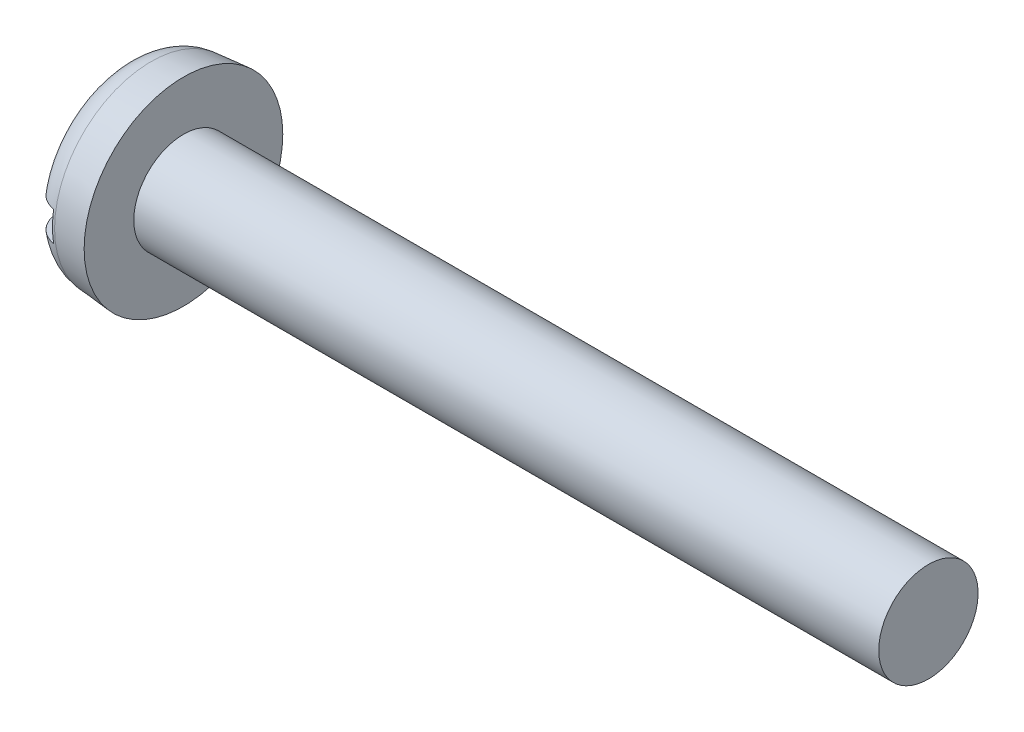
SolidWorks part; units mm, degrees
ref_plane "Plane1" through (0, 0, 0) normal (0, 0, 1) x (1, 0, 0)
ref_plane "Plane2" through (0, 0, 0) normal (0, 1, 0) x (1, 0, 0)
ref_plane "Plane3" through (0, 0, 0) normal (1, 0, 0) x (0, 0, -1)
sketch "BodySke" plane through (0, 0, 0) normal (0, 0, 1) x (1, 0, 0)
  line L0 (2.4, 2) -> (2.4, 4)
  line L1 (0, 0) -> (0, 3.79)
  line L2 (-25.4, 0) -> (127, 0) construction
  line L3 (32.4, 0) -> (0, 0)
  line L4 (2.4, 2) -> (32.4, 2)
  line L5 (32.4, 2) -> (32.4, 0)
  line L6 (0, 3.79) -> (2.4, 4)
  line L9 (3.1, 3.5875) -> (3.1, -5.9375) construction
  line L10 (2.4, 6.35) -> (2.4, -3.175) construction
  dimension "Head_ht" = 2.4
  dimension "Diameter" = 4
  dimension "Length" = 30
  dimension "Head_dia" = 8
  dimension "Advance" = 0.7
  dimension "Thread_nom" = 30
  dimension "Head_side_angle" = 5
revolve "Base-Revolve" add sketch "BodySke"
fillet "Fillet1" [suppressed] radius 0.2
fillet "Fillet2" radius 1.2 1 edges at (0, 0, 3.79)
sketch "Sketch2" plane through (0, 0, 0) normal (1, 0, 0) x (0, 0, -1)
  line L0 (4, -0.6) -> (-4, -0.6)
  line L1 (4, -0.6) -> (4, 0.6)
  line L2 (-4, 0.6) -> (4, 0.6)
  line L3 (-4, 0.6) -> (-4, -0.6)
  dimension "D1" = 8
  dimension "D2" = 4
  dimension "Slot_width" = 1.2
  dimension "D3" = 0.6
extrude "Slot" cut sketch "Sketch2" along normal blind 1
sketch "ThdSchSke" plane through (0, 0, 0) normal (0, 0, 1) x (1, 0, 0)
  line L0 (3.8, -1.61) -> (3.5269, -2)
  line L1 (3.8, -1.61) -> (4.0731, -2)
  line L2 (4.0731, -2) -> (4.0731, -2.5)
  line L3 (-3.175, 0) -> (5.1513, 0) construction
  line L5 (4.0731, -2.5) -> (3.5269, -2.5)
  line L6 (3.5269, -2.5) -> (3.5269, -2)
  dimension "Thread_minor" = 3.22
  dimension "Diameter" = 4
  dimension "Start" = 3.8
  dimension "SideAngle" = 55
  dimension "VeeAngle" = 70
  dimension "Overcut" = 5
revolve "ThreadSchematic" [suppressed] cut sketch "ThdSchSke" angle 360 about L3
pattern_linear "ThdSchPat" [suppressed]
equation "\"D1@Sketch2\" = \"Head_dia@BodySke\""
equation "\"D2@Sketch2\" = \"D1@Sketch2\" / 2"
equation "\"D3@Sketch2\" = \"Slot_width@Sketch2\" / 2"
equation "\"Thread_length@ThreadCosmetic\" = ((sgn( (\"Length@BodySke\" - \"Advance@BodySke\" * 2.0 ) - \"Thread_nom@BodySke\" )-1)*( (\"Length@BodySke\" - \"Advance@BodySke\"  * 2.0) - \"Thread_nom@BodySke\" ))/-2+ \"Thread_"
equation "\"Thread_minor@ThdSchSke\" = \"Thread_minor@ThreadCosmetic\""
equation "\"Diameter@ThdSchSke\" = \"Diameter@BodySke\""
equation "\"Overcut@ThdSchSke\" = \"Diameter@BodySke\" * 1.25"
equation "\"Start@ThdSchSke\" = \"Head_ht@BodySke\" + \"Length@BodySke\" - \"Thread_length@ThreadCosmetic\"  '---Non-countersunk---"
equation "\"Num_threads@ThdSchPat\" = int( \"Thread_length@ThreadCosmetic\" / \"Advance@BodySke\" + 0.999 )  + 1"
equation "\"Advance@ThdSchPat\" = \"Thread_length@ThreadCosmetic\" /  (\"Num_threads@ThdSchPat\" - 1) 'relax it"
